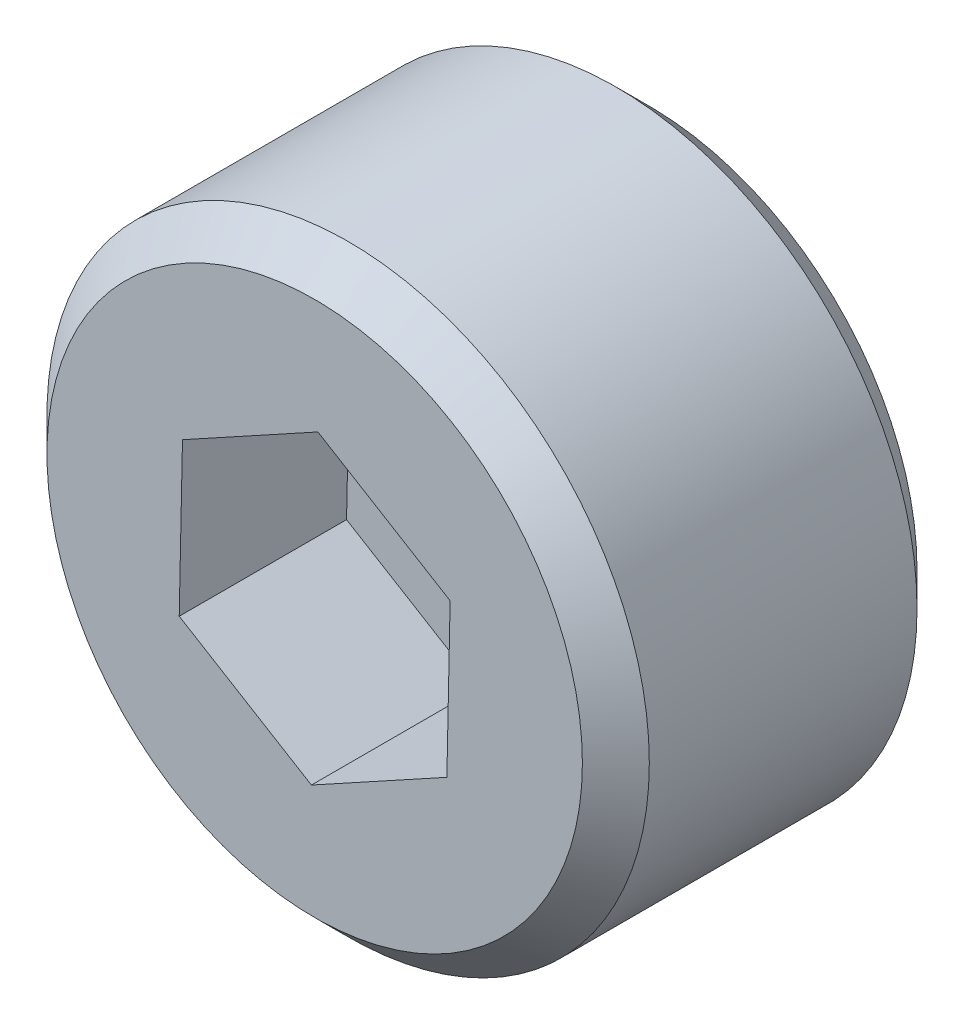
SolidWorks part; units mm, degrees
ref_plane "Alzado" through (0, 0, 0) normal (0, 0, 1) x (1, 0, 0)
ref_plane "Planta" through (0, 0, 0) normal (0, 1, 0) x (1, 0, 0)
ref_plane "Vista lateral" through (0, 0, 0) normal (1, 0, 0) x (0, 0, -1)
sketch "Croquis1" plane through (0, 0, 0) normal (0, 0, 1) x (1, 0, 0)
  circle A0 centre (0, 0) radius 9
  dimension "D1" = 18
extrude "Saliente-Extruir1" add sketch "Croquis1" along normal blind 10
sketch "Croquis2" plane through (0, 0, 10) normal (0, 0, 1) x (1, 0, 0)
  line L1 (-3.9503, 2.3933) -> (-4.0479, -2.2244)
  line L2 (-4.0479, -2.2244) -> (-0.0975, -4.6178)
  line L3 (-0.0975, -4.6178) -> (3.9503, -2.3933)
  line L4 (3.9503, -2.3933) -> (4.0479, 2.2244)
  line L5 (4.0479, 2.2244) -> (0.0975, 4.6178)
  line L6 (0.0975, 4.6178) -> (-3.9503, 2.3933)
  circle A0 centre (0, 0) radius 4 construction
  dimension "D1" = 8
extrude "Cortar-Extruir1" cut sketch "Croquis2" against normal blind 5
chamfer "Chaflán1" distance 1 angle 45 2 edges at (9, 0, 0) (9, 0, 10)
